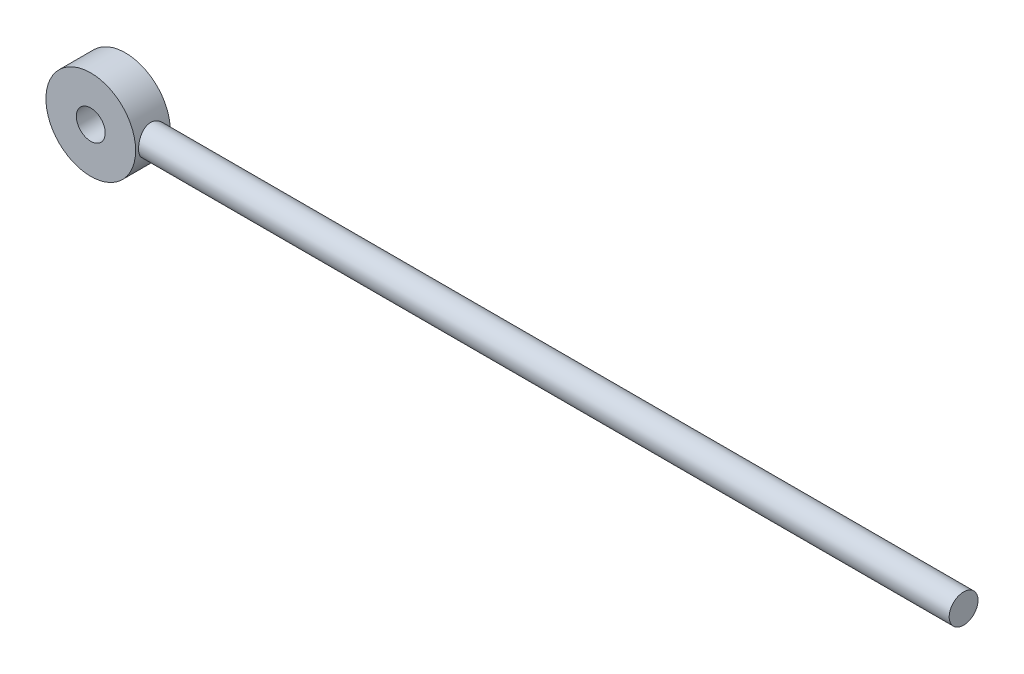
SolidWorks part; units mm, degrees
ref_plane "Front Plane" through (0, 0, 0) normal (0, 0, 1) x (1, 0, 0)
ref_plane "Top Plane" through (0, 0, 0) normal (0, 1, 0) x (1, 0, 0)
ref_plane "Right Plane" through (0, 0, 0) normal (1, 0, 0) x (0, 0, -1)
sketch "Sketch1" plane through (0, 0, 0) normal (0, 0, 1) x (1, 0, 0)
  line L0 (0, 0) -> (234.95, 0)
  line L1 (11.6644, 3.9624) -> (234.95, 3.9624)
  line L2 (234.95, 3.9624) -> (234.95, 0)
  line L3 (11.6644, 3.9624) -> (11.6644, 0)
  circle A0 centre (0, 0) radius 3.9624
  circle A1 centre (0, 0) radius 12.319
  circle A2 centre (0, 0) radius 7.9375
  dimension "D1" = 7.9248
  dimension "D2" = 24.638
  dimension "D5" = 15.875
  dimension "D3" = 3.9624
  dimension "D4" = 234.95
sketch "Sketch2" plane through (0, 0, 0) normal (0, 0, 1) x (1, 0, 0)
  line L0 (11.6644, 3.9624) -> (234.95, 3.9624) construction
  line L1 (11.6644, 3.9624) -> (11.6644, 0) construction
  line L2 (0, 0) -> (234.95, 0) construction
  line L3 (234.95, 3.9624) -> (234.95, 0) construction
  line L4 (11.6644, 3.9624) -> (234.95, 3.9624)
  line L5 (11.6644, 3.9624) -> (11.6644, 0)
  line L6 (11.6644, 0) -> (234.95, 0)
  line L7 (234.95, 3.9624) -> (234.95, 0)
revolve "Revolve1" add sketch "Sketch2" angle 360 about L6
sketch "Sketch3" plane through (0, 0, 0) normal (0, 0, 1) x (1, 0, 0)
  circle A0 centre (0, 0) radius 12.319 construction
  circle A1 centre (0, 0) radius 3.9624 construction
  circle A2 centre (0, 0) radius 12.319
  circle A3 centre (0, 0) radius 3.9624
extrude "Boss-Extrude1" add sketch "Sketch3" along normal mid plane 9.525
